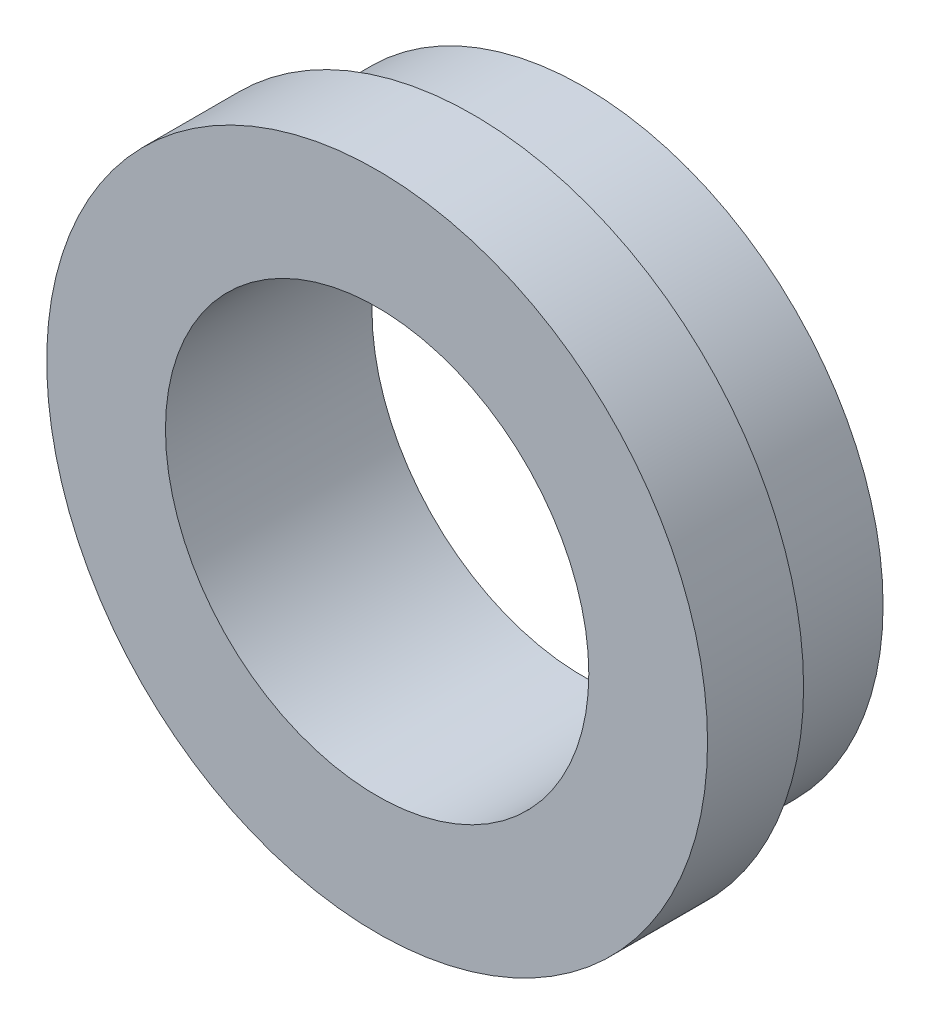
SolidWorks part; units mm, degrees
ref_plane "Plan de face" through (0, 0, 0) normal (0, 0, 1) x (1, 0, 0)
ref_plane "Plan de dessus" through (0, 0, 0) normal (0, 1, 0) x (1, 0, 0)
ref_plane "Plan de droite" through (0, 0, 0) normal (1, 0, 0) x (0, 0, -1)
sketch "Esquisse5" plane through (0, 0, -12.65) normal (0, 0, 1) x (1, 0, 0)
  circle A0 centre (0, 0) radius 16
extrude "Boss.-Extru.8" add sketch "Esquisse5" along normal blind 4.65 contours A0
sketch "Esquisse13" plane through (0, 0, -12.65) normal (0, 0, -1) x (-1, 0, 0)
  circle A0 centre (0, 0) radius 14.5
extrude "Boss.-Extru.9" add sketch "Esquisse13" along normal blind 5.35
sketch "Esquisse14" plane through (0, 0, -18) normal (0, 0, -1) x (-1, 0, 0)
  circle A0 centre (0, 0) radius 10.25
extrude "Enlèv. mat.-Extru.8" cut sketch "Esquisse14" against normal through all
